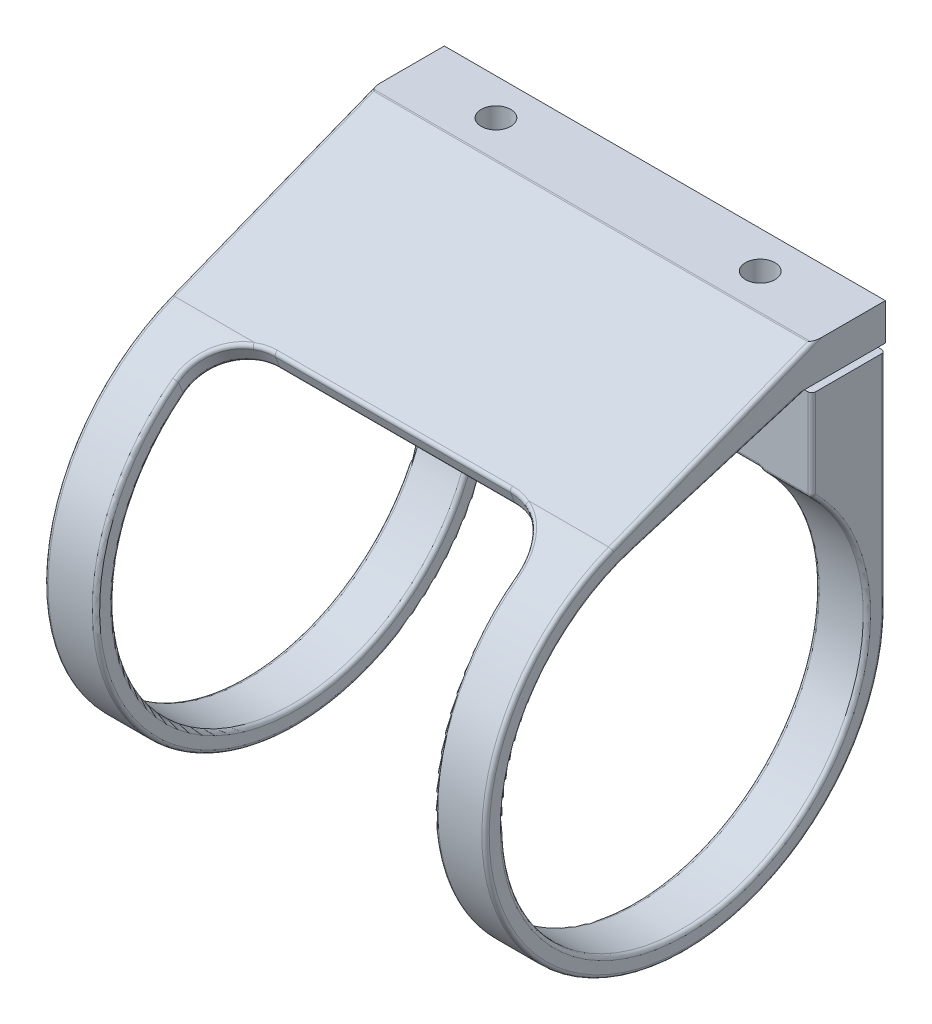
SolidWorks part; units mm, degrees
ref_plane "Front Plane" through (0, 0, 0) normal (0, 0, 1) x (1, 0, 0)
ref_plane "Top Plane" through (0, 0, 0) normal (0, 1, 0) x (1, 0, 0)
ref_plane "Right Plane" through (0, 0, 0) normal (1, 0, 0) x (0, 0, -1)
sketch "Sketch1" plane through (0, 0, 0) normal (1, 0, 0) x (0, 0, -1)
  line L0 (34.544, 45.72) -> (21.844, 45.72)
  line L1 (34.544, 45.72) -> (34.544, 39.37)
  line L2 (34.544, 38.1) -> (21.844, 38.1)
  line L3 (21.844, 45.72) -> (-12.6507, 32.1442)
  line L5 (34.544, 39.37) -> (21.844, 39.37)
  line L6 (21.844, 38.1) -> (21.844, 22.5134)
  line L7 (21.844, 39.37) -> (-9.0732, 30.0282)
  line L8 (34.544, 38.1) -> (34.544, 0)
  arc A0 (-12.6507, 32.1442) -> (34.544, 0) centre (0, 0) ccw
  arc A1 (-9.0732, 30.0282) -> (21.844, 22.5134) centre (0, 0) ccw
  dimension "D1" = 62.738
  dimension "D6" = 12.7
  dimension "D5" = 1.27
  dimension "D2" = 3.175
  dimension "D3" = 45.72
  dimension "D4" = 6.35
extrude "Boss-Extrude1" add sketch "Sketch1" along normal mid plane 76.2
ref_plane "Plane1" through (0, 0, 0) normal (0, 0.3662, -0.9305) x (-1, 0, 0)
ref_plane "Plane2" through (0, 0, -28.194) normal (0, 0, 1) x (1, 0, 0)
sketch "Sketch26" plane through (0, 0, 0) normal (0, 0.3662, -0.9305) x (-1, 0, 0)
  line L9 (75.3774, 0) -> (-21.3436, 0) construction
  line L10 (-38.1, 0) -> (38.1, 0) construction
  line L13 (29.21, 53.7773) -> (-29.21, 53.7773)
  line L14 (29.21, 53.7773) -> (29.21, 6.2206)
  line L16 (29.21, 6.2206) -> (-29.21, 6.2206)
  line L17 (-29.21, 53.7773) -> (-29.21, 6.2206)
  line L18 (0, 0) -> (0, 6.2206) construction
  line L19 (38.1, -34.544) -> (38.1, 34.544) construction
  dimension "D1" = 8.89
revolve "Cut-Revolve2" cut sketch "Sketch26" angle 260 about L9
hole_wizard "#7 (0.201) Diameter Hole1" positions "Sketch28" profile "Sketch27" hole size "#7" standard "ANSI Inch"
sketch "Sketch28" plane through (0, 45.72, 0) normal (0, -1, 0) x (-1, 0, 0)
  line L2 (-22.881, 28.1429) -> (22.881, 28.2454) construction
  line L3 (0, 0) -> (0, 28.1941) construction
  circle A6 centre (-0.2576, 143.2246) radius 117.2843 construction
  point P26 (22.881, 28.2454)
  point P28 (-22.881, 28.1429)
  dimension "D1" = 45.7621
sketch "Sketch27" plane through (-22.881, 45.72, -28.2454) normal (1, 0, 0) x (0, 0, 1)
  line L0 (0, 0) -> (0, 6.35)
  line L1 (0, 6.35) -> (2.5527, 6.35)
  line L2 (2.5527, 6.35) -> (2.5527, 0)
  line L5 (2.5527, 0) -> (0, 0)
  line L11 (0, -6.35) -> (0, 107.95) construction
  dimension "Thru Hole Dia." = 5.1054
  dimension "Thru Hole Depth" = 6.35
sketch "Sketch29" plane through (0, 0, -21.844) normal (0, 0, 1) x (1, 0, 0)
  line L0 (38.1, 22.5134) -> (-38.1, 22.5134) construction
  line L1 (-29.21, 22.5134) -> (29.21, 22.5134)
  line L2 (-29.21, 22.5134) -> (-29.21, 6.2447)
  line L3 (-29.21, 6.2447) -> (29.21, 6.2447)
  line L4 (29.21, 22.5134) -> (29.21, 6.2447)
  line L5 (0, 45.72) -> (0, 22.5134) construction
  line L6 (38.1, 45.72) -> (-38.1, 45.72) construction
  line L7 (-29.21, -31.369) -> (-29.21, 29.1897) construction
  line L8 (-29.21, 6.2447) -> (29.21, 6.2447) construction
extrude "Cut-Extrude11" cut sketch "Sketch29" against normal blind 12.7
hole_wizard "1/4-20 Tapped Hole1" positions "Sketch34" profile "Sketch33" tap size "1/4-20" standard "ANSI Inch"
sketch "Sketch34" plane through (0, 22.5134, 0) normal (0, 1, 0) x (1, 0, 0)
  circle A0 centre (-22.881, 28.2454) radius 2.5527 construction
  circle A1 centre (22.881, 28.1429) radius 2.5527 construction
  point P0 (-22.881, 28.2454)
  point P3 (22.881, 28.1429)
sketch "Sketch33" plane through (-22.881, 22.5134, -28.2454) normal (1, 0, 0) x (0, 0, -1)
  line L0 (0, 0) -> (0, 17.2818)
  line L1 (0, 17.2818) -> (2.5527, 15.748)
  line L2 (2.5527, 15.748) -> (2.5527, 0)
  line L5 (2.5527, 0) -> (0, 0)
  line L10 (0, 17.2818) -> (-2.5527, 15.748) construction
  line L11 (0, -6.35) -> (0, 107.95) construction
  dimension "Tap Drill Dia." = 5.1054
  dimension "Tap Drill Depth" = 15.748
  dimension "Drill Angle" = 118
fillet "Fillet8" radius 8.89 2 edges at (-29.21, 30.6669, 12.0694) (29.21, 30.6669, 12.0694)
fillet "Fillet9" radius 0.635 25 edges at (29.21, 11.2567, -34.544) (29.21, -30.8329, 15.5762) (25.8705, 31.3806, 14.4412) (38.1, -30.4815, 7.4089) (0, 32.1442, 12.6507) (-27.3267, 30.7345, 15.7696) (-29.21, -30.8329, 15.5762) (-29.21, -31.3233, 1.6935) (-25.8699, 28.4212, 13.2759) (0, 29.1897, 11.488) (27.3407, 27.7555, 14.6166) (-38.1, 34.6991, -6.3854) (-38.1, 38.9321, -4.5966) (-38.1, -28.5508, 19.4458) (38.1, 38.9321, -4.5966) (38.1, -28.5508, 19.4458) (38.1, 30.3067, -21.844) (-38.1, 30.3067, -21.844) (38.1, 34.6991, -6.3854) (0, 45.72, -21.844) (-29.21, 11.2567, -34.544) (29.21, -31.3233, 1.6935) (-38.1, -30.4815, 7.4089) (-38.1, 19.05, -34.544) (38.1, 19.05, -34.544)
fillet "Fillet14" radius 0.635 6 edges at (-29.396, 22.5134, -34.358) (-29.5357, 22.5134, -21.9593) (29.396, 22.5134, -34.358) (29.4177, 22.5134, -22.0807) (-29.21, 22.5134, -28.3277) (29.21, 22.5134, -28.3277)
fillet "Fillet15" radius 0.635 10 edges at (37.8383, 22.5647, -21.9653) (33.9829, 22.5134, -21.844) (30.3165, 22.5037, -21.844) (-37.8383, 22.5647, -21.9653) (-33.9829, 22.5134, -21.844) (-29.3735, 22.5037, -21.844) (29.0626, 22.4567, -34.544) (-29.0626, 22.4567, -34.544) (0, 22.5134, -21.844) (0, 22.5134, -34.544)
